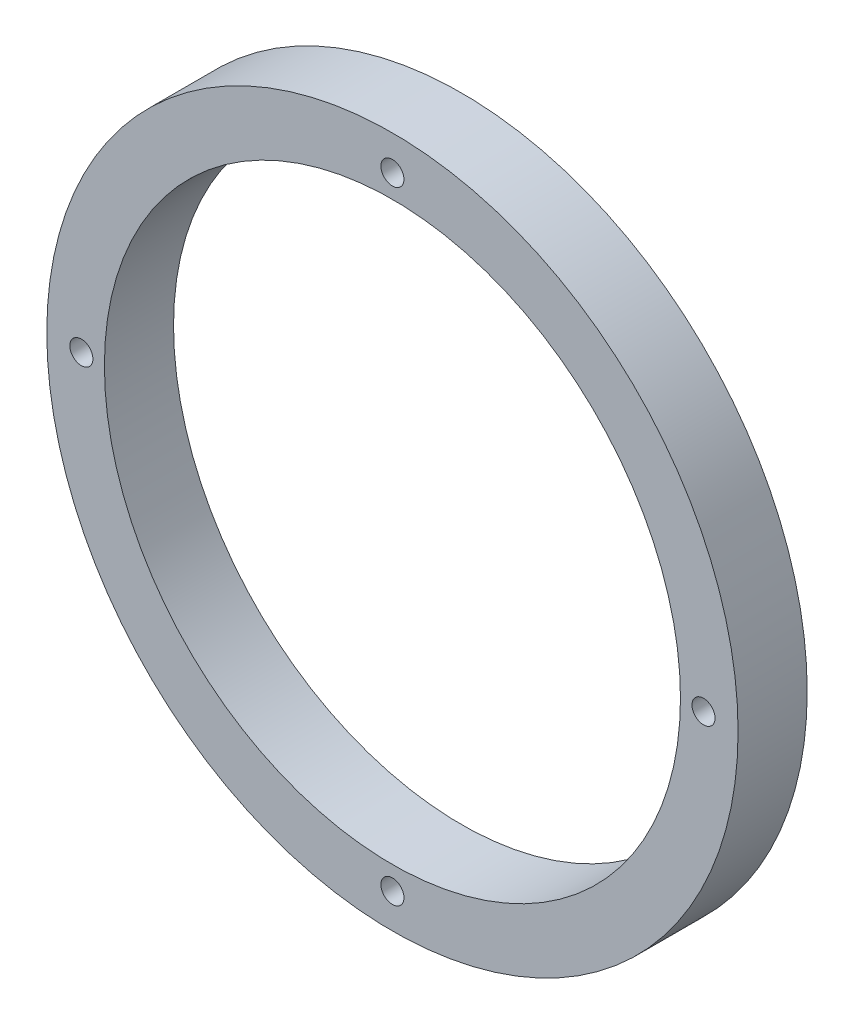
SolidWorks part; units mm, degrees
ref_plane "Plan de face" through (0, 0, 0) normal (0, 0, 1) x (1, 0, 0)
ref_plane "Plan de dessus" through (0, 0, 0) normal (0, 1, 0) x (1, 0, 0)
ref_plane "Plan de droite" through (0, 0, 0) normal (1, 0, 0) x (0, 0, -1)
sketch "Esquisse1" plane through (0, 0, 0) normal (0, 0, 1) x (1, 0, 0)
  circle A0 centre (0, 0) radius 15
  circle A1 centre (0, 0) radius 12.5
  dimension "D1" = 30
  dimension "D2" = 25
extrude "Extrusion1" add sketch "Esquisse1" along normal blind 3
sketch "Esquisse2" plane through (0, 0, 3) normal (0, 0, 1) x (1, 0, 0)
  circle A0 centre (0, 13.5) radius 0.5
  dimension "D1" = 1
  dimension "D2" = 13.5
extrude "Enlèv. mat.-Extru.1" cut sketch "Esquisse2" against normal through all
pattern_circular "Répétition circulaire1" count 4 over 360 about axis through (0, 0, 0) along (0, 0, 1) of "Enlèv. mat.-Extru.1"
